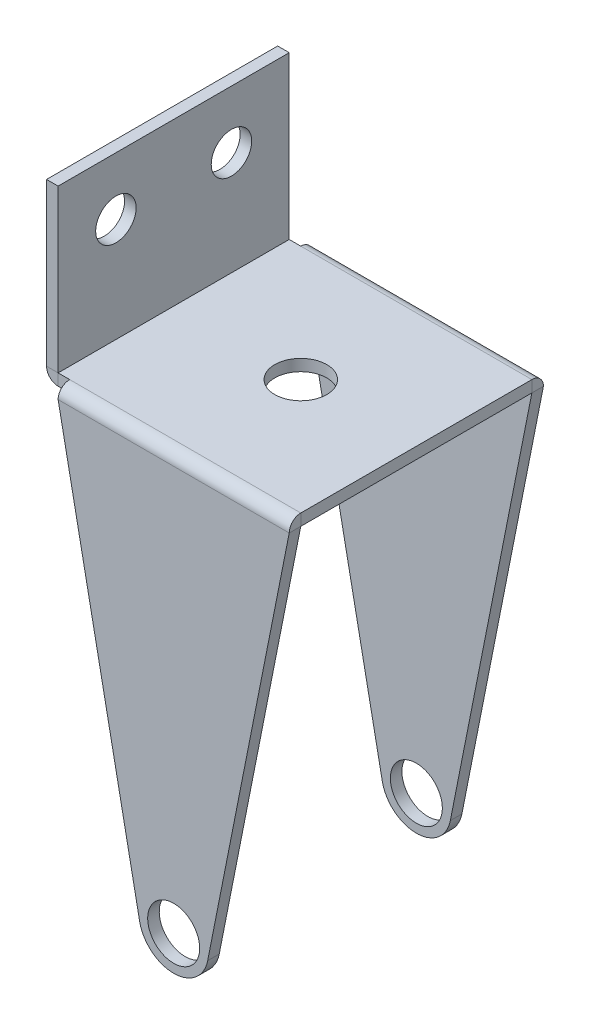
SolidWorks part; units mm, degrees
ref_plane "Front Plane" through (0, 0, 0) normal (0, 0, 1) x (1, 0, 0)
ref_plane "Top Plane" through (0, 0, 0) normal (0, 1, 0) x (1, 0, 0)
ref_plane "Right Plane" through (0, 0, 0) normal (1, 0, 0) x (0, 0, -1)
sketch "Sketch1" plane through (0, 0, 0) normal (0, 1, 0) x (1, 0, 0)
  line L0 (0, 0) -> (0, 90.6273) construction
  line L1 (-10, 10) -> (-2.9427, 45.5836)
  line L2 (-10, 10) -> (-25, 10)
  line L3 (10, 10) -> (2.9427, 45.5836)
  line L4 (10, 10) -> (10, -10)
  line L5 (-28.2013, 0) -> (51.6822, 0) construction
  line L6 (-10, -10) -> (-2.9427, -45.5836)
  line L7 (10, -10) -> (2.9427, -45.5836)
  line L8 (-25, 10) -> (-25, -10)
  line L9 (-25, -10) -> (-10, -10)
  circle A0 centre (0, 0) radius 2.25
  circle A1 centre (0, 45) radius 2.25
  arc A2 (2.9427, 45.5836) -> (-2.9427, 45.5836) centre (0, 45) ccw
  arc A3 (2.9427, -45.5836) -> (-2.9427, -45.5836) centre (0, -45) cw
  circle A4 centre (0, -45) radius 2.25
  circle A5 centre (-20, 5) radius 1.75
  circle A6 centre (-20, -5) radius 1.75
  point P22 (10, 0)
  dimension "D1" = 2.25
  dimension "D6" = 4.5
  dimension "D7" = 35
  dimension "D8" = 6
  dimension "D10" = 3.5
  dimension "D11" = 3.5
  dimension "D12" = 5
  dimension "D13" = 5
  dimension "D14" = 5
  dimension "D15" = 5
  dimension "D2" = 10
  dimension "D3" = 10
  dimension "D4" = 10
  dimension "D5" = 15
  dimension "D9" = 10
sheet metal parameters "Sheet-Metal1" thickness 1 parameters "D1"=0.0001
base flange "Base-Flange1" sketch "Sketch1" thickness 1 reverse thickness direction yes parameters "D1"=0.0001
sketch "Sketch3" plane through (0, 1, 0) normal (0, 1, 0) x (1, 0, 0)
  line L1 (-11, 10) -> (-11, -10)
  line L2 (-10, 10) -> (-25, 10) construction
  line L3 (-25, -10) -> (-10, -10) construction
  line L4 (-25, 10) -> (-25, -10) construction
  dimension "D1" = 14
sketched bend "Sketched Bend1" parameters "D1"=0.001
bend "SketchBend4" bend radius 0.0001 bend angle 90 parameters "D5"=4
sketch "Sketch4" plane through (0, 1, 0) normal (0, 1, 0) x (1, 0, 0)
  line L1 (10, -10) -> (-10, -10)
  line L2 (-10, -10) -> (-2.9427, -45.5836) construction
  line L3 (-10, 10) -> (10, 10)
sketched bend "Sketched Bend2" parameters "D1"=0
bend "SketchBend3" bend radius 0.0001 bend angle 90 parameters "D5"=3
bend "SketchBend5" bend radius 0 bend angle 90 parameters "D5"=6
flat pattern "Flat-Pattern1"
sketch "Bend-Lines1" plane through (0, 0, 0) normal (0, 1, 0) x (-1, 0, 0)
bend of the flat pattern "Flatten-<SketchBend3>1"
bend of the flat pattern "Flatten-<SketchBend4>1"
bend of the flat pattern "Flatten-<SketchBend5>1"
